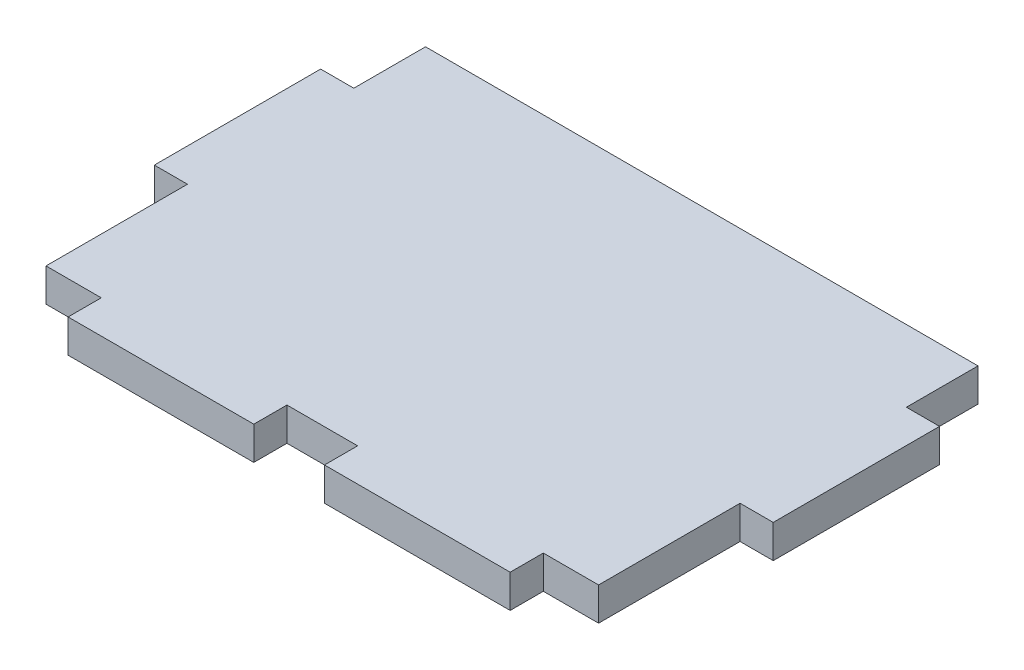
SolidWorks part; units mm, degrees
ref_plane "Спереди" through (0, 0, 0) normal (0, 0, 1) x (1, 0, 0)
ref_plane "Сверху" through (0, 0, 0) normal (0, 1, 0) x (1, 0, 0)
ref_plane "Справа" through (0, 0, 0) normal (1, 0, 0) x (0, 0, -1)
sketch "Эскиз1" plane through (0, 0, 0) normal (0, 1, 0) x (1, 0, 0)
  line L0 (-874.4378, 468.7575) -> (-874.4378, 462.2772)
  line L1 (-919.4378, 431.4249) -> (-902.6355, 431.4249)
  line L2 (-927.4378, 447.2275) -> (-927.4378, 462.2772)
  line L3 (-874.4378, 468.7575) -> (-871.4378, 468.7575) construction
  line L4 (-871.4378, 447.2275) -> (-871.4378, 462.2772)
  line L5 (-874.4378, 462.2772) -> (-871.4378, 462.2772)
  line L6 (-924.4378, 468.7675) -> (-924.4378, 462.2772)
  line L7 (-924.4378, 462.2772) -> (-927.4378, 462.2772)
  line L8 (-927.4378, 447.2275) -> (-924.4378, 447.2275)
  line L9 (-924.4378, 447.2275) -> (-924.4378, 434.4249)
  line L10 (-871.4378, 447.2275) -> (-874.4378, 447.2275)
  line L11 (-874.4378, 447.2275) -> (-874.4378, 434.4249)
  line L12 (-924.4378, 434.4249) -> (-919.4378, 434.4249)
  line L13 (-919.4378, 434.4249) -> (-919.4378, 431.4249)
  line L14 (-902.6355, 431.4249) -> (-902.6355, 434.4249)
  line L15 (-902.6355, 434.4249) -> (-896.2401, 434.4249)
  line L16 (-896.2401, 434.4249) -> (-896.2401, 431.4249)
  line L17 (-879.4378, 431.4249) -> (-879.4378, 434.4249)
  line L18 (-879.4378, 434.4249) -> (-874.4378, 434.4249)
  line L19 (-896.2401, 431.4249) -> (-879.4378, 431.4249)
  line L20 (-877.4378, 468.7575) -> (-874.4378, 468.7575) construction
  line L21 (-924.4378, 468.7675) -> (-874.4378, 468.7575)
extrude "Бобышка-Вытянуть1" add sketch "Эскиз1" along normal blind 3
